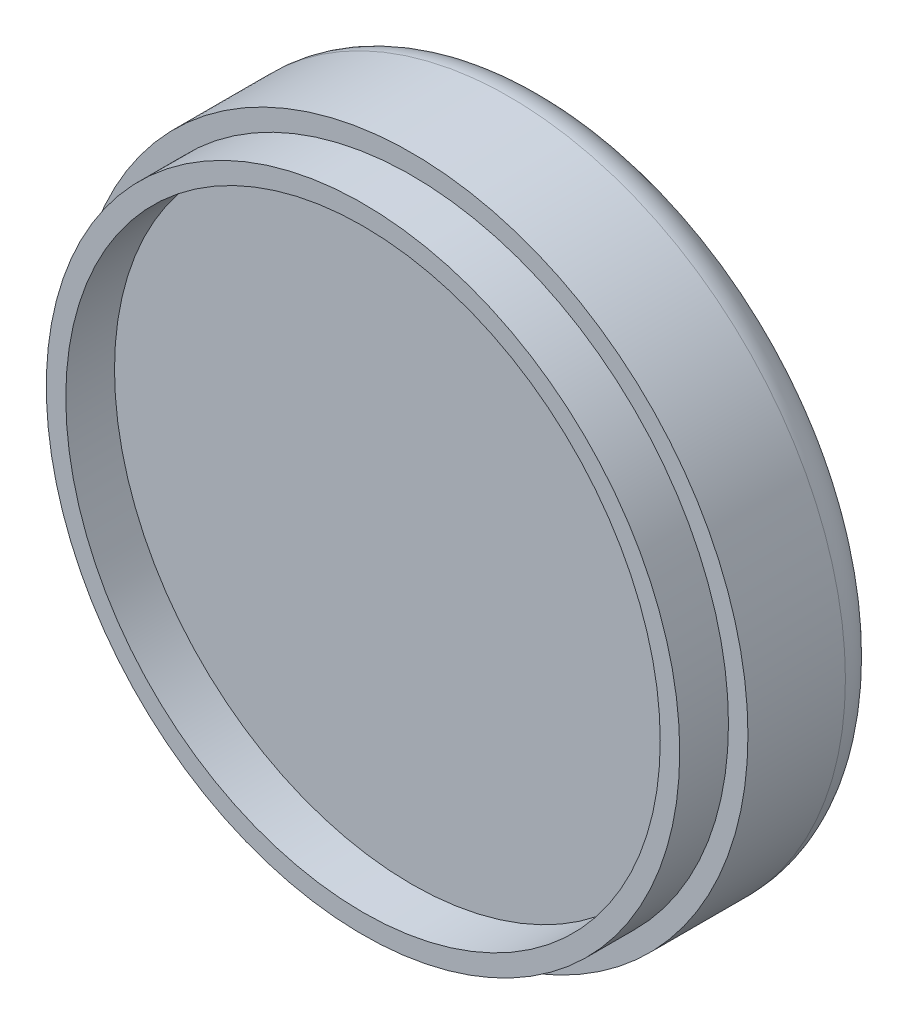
SolidWorks part; units mm, degrees
ref_plane "Plan de face" through (0, 0, 0) normal (0, 0, 1) x (1, 0, 0)
ref_plane "Plan de dessus" through (0, 0, 0) normal (0, 1, 0) x (1, 0, 0)
ref_plane "Plan de droite" through (0, 0, 0) normal (1, 0, 0) x (0, 0, -1)
sketch "Esquisse1" plane through (0, 0, 0) normal (0, 0, 1) x (1, 0, 0)
  circle A0 centre (0, 0) radius 34.5
  dimension "D1" = 69
extrude "Boss.-Extru.1" add sketch "Esquisse1" along normal blind 14
sketch "Esquisse2" plane through (0, 0, 14) normal (0, 0, 1) x (1, 0, 0)
  circle A0 centre (0, 0) radius 32.5
  circle A1 centre (0, 0) radius 30.5
  point P5 (0.6465, 0)
  dimension "D1" = 65
  dimension "D2" = 61
extrude "Boss.-Extru.2" add sketch "Esquisse2" along normal blind 5
fillet "Congé1" radius 4 1 edges at (34.5, 0, 0)
